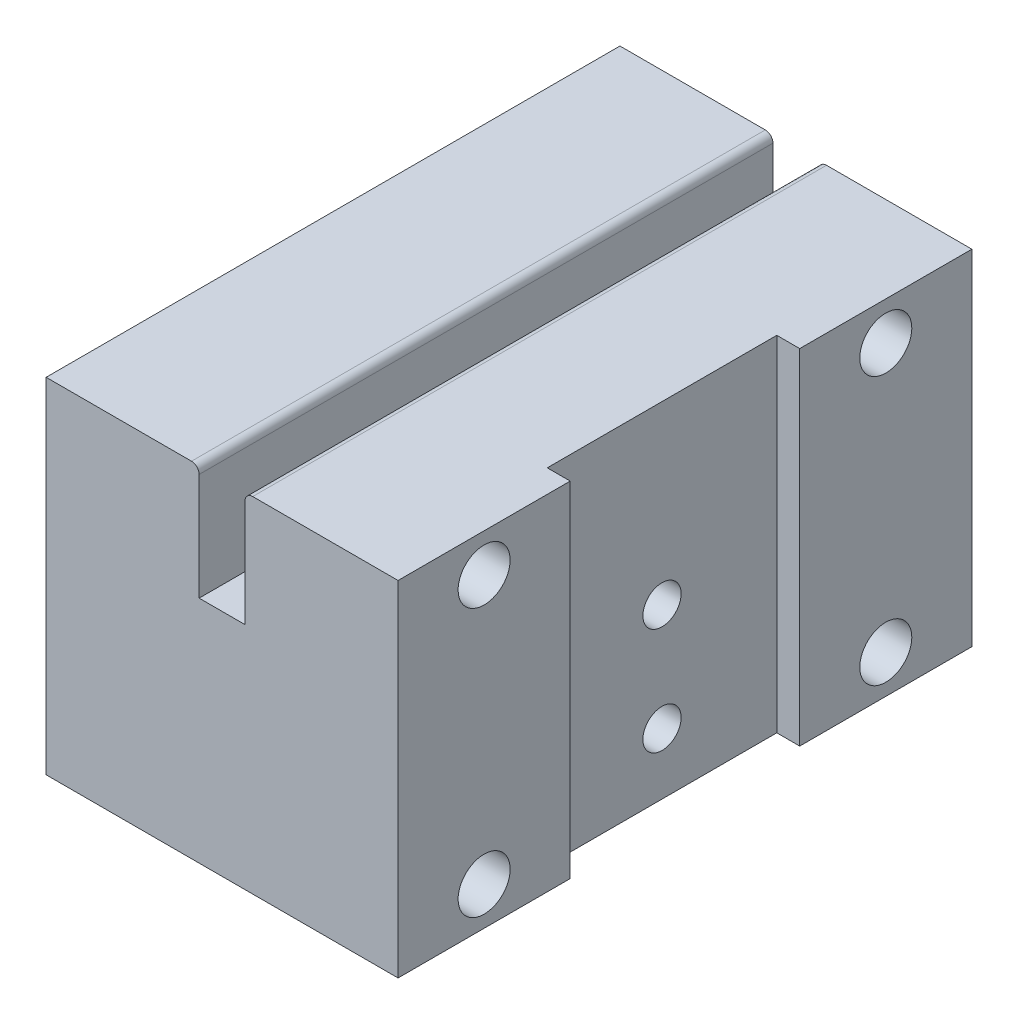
SolidWorks part; units mm, degrees
ref_plane "Front Plane" through (0, 0, 0) normal (0, 0, 1) x (1, 0, 0)
ref_plane "Top Plane" through (0, 0, 0) normal (0, 1, 0) x (1, 0, 0)
ref_plane "Right Plane" through (0, 0, 0) normal (1, 0, 0) x (0, 0, -1)
sketch "Sketch2" plane through (0, 0, 0) normal (0, 0, 1) x (1, 0, 0)
  line L1 (-23, 22.5) -> (23, 22.5)
  line L2 (-23, 22.5) -> (-23, -22.5)
  line L3 (-23, -22.5) -> (23, -22.5)
  line L4 (23, 22.5) -> (23, -22.5)
  line L5 (-23, 22.5) -> (23, -22.5) construction
  line L6 (-23, -22.5) -> (23, 22.5) construction
  point P0 (0, 0)
  dimension "D1" = 46
  dimension "D2" = 45
extrude "Boss-Extrude1" add sketch "Sketch2" along normal mid plane 75
sketch "Sketch3" plane through (0, 0, 37.5) normal (0, 0, 1) x (1, 0, 0)
  line L0 (23, 22.5) -> (-23, 22.5) construction
  line L1 (-3, 22.5) -> (3, 22.5)
  line L2 (-3, 22.5) -> (-3, 7.5)
  line L3 (-3, 7.5) -> (3, 7.5)
  line L4 (3, 22.5) -> (3, 7.5)
  line L5 (-23, -22.5) -> (23, -22.5) construction
  point P8 (0, -22.5)
  point P9 (0, 7.5)
  dimension "D1" = 6
  dimension "D2" = 15
extrude "Cut-Extrude2" cut sketch "Sketch3" against normal through all and the other way through all
fillet "Fillet1" radius 1 2 edges at (3, 22.5, 0) (-3, 22.5, 0)
sketch "Sketch5" plane through (23, 0, 0) normal (1, 0, 0) x (0, 0, -1)
  line L1 (-37.5, 22.5) -> (37.5, 22.5) construction
  line L2 (-15, 22.5) -> (-15, -22.5)
  line L3 (-37.5, -22.5) -> (37.5, -22.5) construction
  line L4 (-15, 22.5) -> (15, 22.5)
  line L5 (-15, -22.5) -> (15, -22.5)
  line L6 (37.5, -22.5) -> (37.5, 22.5) construction
  line L17 (15, 22.5) -> (15, -22.5)
  dimension "D2" = 30
  dimension "D1" = 22.5
extrude "Cut-Extrude3" cut sketch "Sketch5" against normal blind 3
sketch "Sketch6" plane through (0, -22.5, 0) normal (0, -1, 0) x (1, 0, 0)
  line L0 (-23, 37.5) -> (23, 37.5) construction
  line L1 (-23, -37.5) -> (23, -37.5) construction
  line L2 (-23, 37.5) -> (-23, -37.5) construction
  point P0 (-19.5, 27.5)
  point P1 (0.5, 27.5)
  point P2 (-19.5, -27.5)
  point P3 (0.5, -27.5)
  dimension "D1" = 20
  dimension "D2" = 10
  dimension "D3" = 10
  dimension "D4" = 3.5
sketch "Sketch7" plane through (20, 0, 0) normal (1, 0, 0) x (0, 0, -1)
  line L0 (-15, -22.5) -> (15, -22.5) construction
  line L2 (-15, 22.5) -> (-15, -22.5) construction
  circle A0 centre (0, -0.5) radius 2.5
  circle A1 centre (0, -14.5) radius 2.5
  dimension "D1" = 5
  dimension "D2" = 5
  dimension "D5" = 15
  dimension "D3" = 8
  dimension "D4" = 14
extrude "Cut-Extrude4" cut sketch "Sketch7" against normal blind 20
sketch "Sketch8" plane through (23, 0, 0) normal (1, 0, 0) x (0, 0, -1)
  line L0 (-37.5, 22.5) -> (-15, 22.5) construction
  line L2 (-37.5, -22.5) -> (-37.5, 22.5) construction
  circle A0 centre (-26.25, 17.5) radius 3.4
  circle A1 centre (26.25, 17.5) radius 3.4
  circle A2 centre (26.25, -17.5) radius 3.4
  circle A3 centre (-26.25, -17.5) radius 3.4
  dimension "D3" = 5
  dimension "D4" = 11.25
  dimension "D5" = 6.8
  dimension "D6" = 35
  dimension "D7" = 52.5
  dimension "D8" = 52.5
  dimension "D1" = 2
  dimension "D2" = 2
extrude "Cut-Extrude5" cut sketch "Sketch8" against normal blind 15
